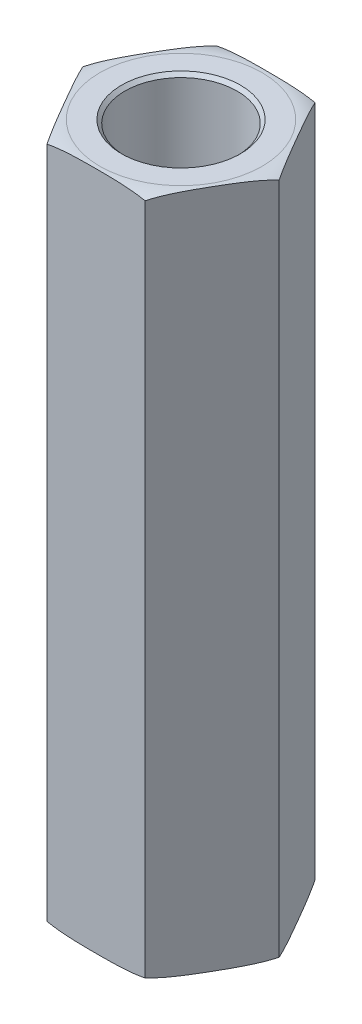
SolidWorks part; units mm, degrees
ref_plane "Front" through (0, 0, 0) normal (0, 0, 1) x (1, 0, 0)
ref_plane "Top" through (0, 0, 0) normal (0, 1, 0) x (1, 0, 0)
ref_plane "Right" through (0, 0, 0) normal (1, 0, 0) x (0, 0, -1)
imported_body "Imported3"
hole_wizard "#6 Clearance Hole1" positions "Sketch2" profile "Sketch1" hole size "#6" standard "ANSI Inch"
sketch "Sketch2" plane through (0, -12.7, 0) normal (0, -1, 0) x (-1, 0, 0)
  point P0 (0, 0)
sketch "Sketch1" plane through (0, -12.7, 0) normal (1, 0, 0) x (0, 0, -1)
  line L0 (0, 0) -> (0, 25.8424)
  line L1 (0, 25.8424) -> (2.0955, 25.8424)
  line L2 (2.0955, 25.8424) -> (2.0955, 0)
  line L5 (2.0955, 0) -> (0, 0)
  line L11 (0, -6.35) -> (0, 107.95) construction
  dimension "Thru Hole Dia." = 4.191
  dimension "Thru Hole Depth" = 25.8424
chamfer "Chamfer1" distance 0.127 angle 45 2 edges at (0, 12.7, -2.0955) (0, -12.7, -2.0955)
